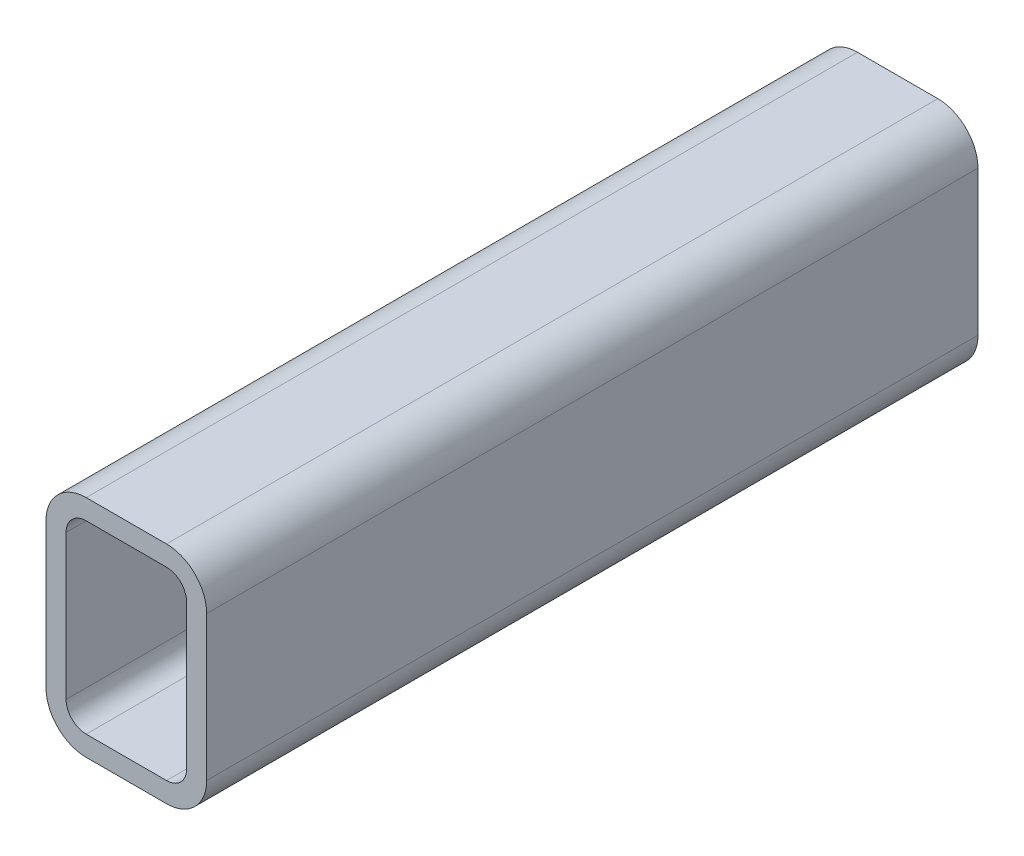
SolidWorks part; units mm, degrees
ref_plane "Front Plane" through (0, 0, 0) normal (0, 0, 1) x (1, 0, 0)
ref_plane "Top Plane" through (0, 0, 0) normal (0, 1, 0) x (1, 0, 0)
ref_plane "Right Plane" through (0, 0, 0) normal (1, 0, 0) x (0, 0, -1)
sketch "Sketch1" plane through (0, 0, 0) normal (0, 0, 1) x (1, 0, 0)
sketch_block_instance "HSS3.5x2.5x0.3125-1"
sketch_block "HSS3.5x2.5x0.3125"
extrude "Boss-Extrude1" add sketch "Sketch1" along normal blind 304.8
